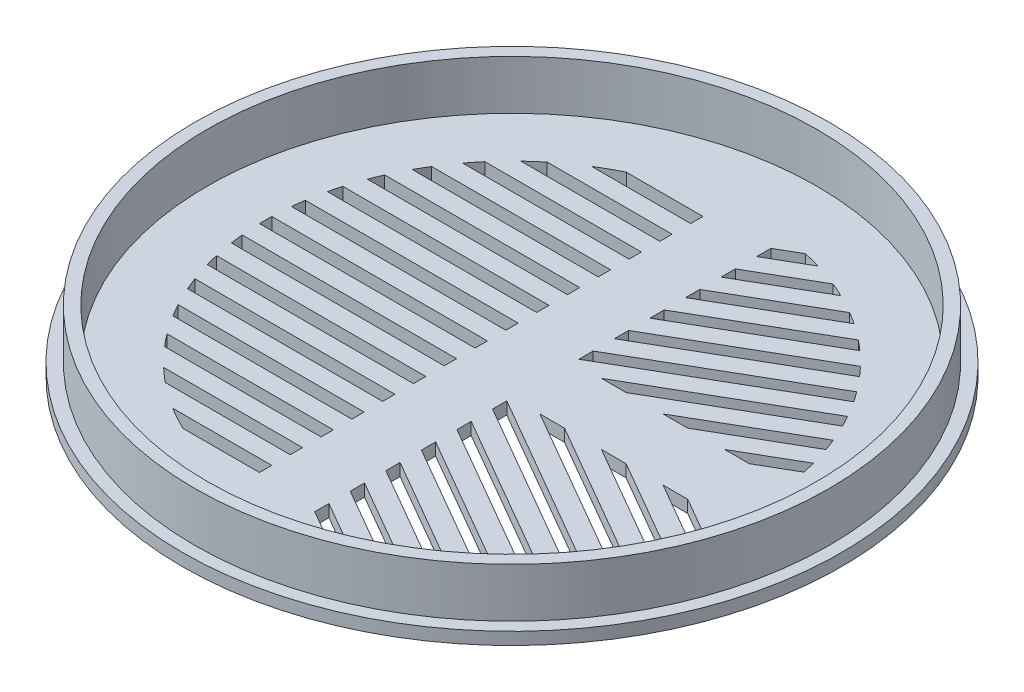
SolidWorks part; units mm, degrees
ref_plane "Front Plane" through (0, 0, 0) normal (0, 0, 1) x (1, 0, 0)
ref_plane "Top Plane" through (0, 0, 0) normal (0, 1, 0) x (1, 0, 0)
ref_plane "Right Plane" through (0, 0, 0) normal (1, 0, 0) x (0, 0, -1)
sketch "OuterCircles Sketch" plane through (0, 0, 0) normal (0, 1, 0) x (1, 0, 0)
  line L0 (0, 74.2626) -> (0, -74.2626) construction
  line L1 (0, -55) -> (0, 55) construction
  line L2 (-6.6339, 0) -> (6.6339, 0) construction
  line L3 (5, 0) -> (5, 39.6863) construction
  line L5 (0, -5) -> (0, 5) construction
  line L6 (0, 5) -> (39.6863, 5) construction
  circle A0 centre (0, 0) radius 51.5
  circle A1 centre (0, 0) radius 53.5
  circle A2 centre (0, 0) radius 49.5
  circle A4 centre (0, 0) radius 40 construction
  point P4 (0, 0)
  point P12 (19.8431, 0)
  dimension "D1" = 103
  dimension "D2" = 107
  dimension "D3" = 2
  dimension "D4" = 80
  dimension "D5" = 5
  dimension "D6" = 5
sketch "Sketch2" plane through (0, 0, 0) normal (0, 1, 0) x (1, 0, 0)
  circle A0 centre (0, 0) radius 53.5
  circle A3 centre (0, 0) radius 53.5 construction
extrude "BasePlate" add sketch "Sketch2" along normal blind 2
sketch "Horizontal Slits" plane through (0, 0, 0) normal (0, 1, 0) x (1, 0, 0)
  line L0 (-6.6339, 0) -> (6.6339, 0) construction
  line L1 (-55, 1) -> (-5, 1)
  line L2 (-55, 1) -> (-55, -1)
  line L3 (-55, -1) -> (-5, -1)
  line L4 (-5, 1) -> (-5, -1)
  line L5 (-55, 1) -> (-5, -1) construction
  line L6 (-55, -1) -> (-5, 1) construction
  line L7 (0, 74.2626) -> (0, -74.2626) construction
  line L8 (-55, 6) -> (-5, 6)
  line L9 (-55, 6) -> (-55, 4)
  line L10 (-55, 4) -> (-5, 4)
  line L11 (-5, 6) -> (-5, 4)
  line L12 (-55, 6) -> (-5, 4) construction
  line L13 (-55, 4) -> (-5, 6) construction
  line L14 (-55, 11) -> (-5, 11)
  line L15 (-55, 11) -> (-55, 9)
  line L16 (-55, 9) -> (-5, 9)
  line L17 (-5, 11) -> (-5, 9)
  line L18 (-55, 11) -> (-5, 9) construction
  line L19 (-55, 9) -> (-5, 11) construction
  line L20 (-55, 16) -> (-5, 16)
  line L21 (-55, 16) -> (-55, 14)
  line L22 (-55, 14) -> (-5, 14)
  line L23 (-5, 16) -> (-5, 14)
  line L24 (-55, 16) -> (-5, 14) construction
  line L25 (-55, 14) -> (-5, 16) construction
  line L26 (-55, 21) -> (-5, 21)
  line L27 (-55, 21) -> (-55, 19)
  line L28 (-55, 19) -> (-5, 19)
  line L29 (-5, 21) -> (-5, 19)
  line L30 (-55, 21) -> (-5, 19) construction
  line L31 (-55, 19) -> (-5, 21) construction
  line L32 (-55, 26) -> (-5, 26)
  line L33 (-55, 26) -> (-55, 24)
  line L34 (-55, 24) -> (-5, 24)
  line L35 (-5, 26) -> (-5, 24)
  line L36 (-55, 26) -> (-5, 24) construction
  line L37 (-55, 24) -> (-5, 26) construction
  line L38 (-55, 31) -> (-5, 31)
  line L39 (-55, 31) -> (-55, 29)
  line L40 (-55, 29) -> (-5, 29)
  line L41 (-5, 31) -> (-5, 29)
  line L42 (-55, 31) -> (-5, 29) construction
  line L43 (-55, 29) -> (-5, 31) construction
  line L44 (-55, 36) -> (-5, 36)
  line L45 (-55, 36) -> (-55, 34)
  line L46 (-55, 34) -> (-5, 34)
  line L47 (-5, 36) -> (-5, 34)
  line L48 (-55, 36) -> (-5, 34) construction
  line L49 (-55, 34) -> (-5, 36) construction
  line L50 (18.5063, 0) -> (35.3976, 0) construction
  line L51 (-55, -34) -> (-5, -36) construction
  line L52 (-55, -36) -> (-5, -34) construction
  line L53 (-55, -29) -> (-5, -31) construction
  line L54 (-55, -31) -> (-5, -29) construction
  line L55 (-55, -24) -> (-5, -26) construction
  line L56 (-55, -26) -> (-5, -24) construction
  line L57 (-55, -19) -> (-5, -21) construction
  line L58 (-55, -21) -> (-5, -19) construction
  line L59 (-55, -14) -> (-5, -16) construction
  line L60 (-55, -16) -> (-5, -14) construction
  line L61 (-55, -9) -> (-5, -11) construction
  line L62 (-55, -11) -> (-5, -9) construction
  line L63 (-55, -4) -> (-5, -6) construction
  line L64 (-55, -6) -> (-5, -4) construction
  line L65 (-5, -36) -> (-5, -34)
  line L66 (-55, -34) -> (-5, -34)
  line L67 (-55, -36) -> (-55, -34)
  line L68 (-55, -36) -> (-5, -36)
  line L69 (-5, -31) -> (-5, -29)
  line L70 (-55, -29) -> (-5, -29)
  line L71 (-55, -31) -> (-55, -29)
  line L72 (-55, -31) -> (-5, -31)
  line L73 (-5, -26) -> (-5, -24)
  line L74 (-55, -24) -> (-5, -24)
  line L75 (-55, -26) -> (-55, -24)
  line L76 (-55, -26) -> (-5, -26)
  line L77 (-5, -21) -> (-5, -19)
  line L78 (-55, -19) -> (-5, -19)
  line L79 (-55, -21) -> (-55, -19)
  line L80 (-55, -21) -> (-5, -21)
  line L81 (-5, -16) -> (-5, -14)
  line L82 (-55, -14) -> (-5, -14)
  line L83 (-55, -16) -> (-55, -14)
  line L84 (-55, -16) -> (-5, -16)
  line L85 (-5, -11) -> (-5, -9)
  line L86 (-55, -9) -> (-5, -9)
  line L87 (-55, -11) -> (-55, -9)
  line L88 (-55, -11) -> (-5, -11)
  line L89 (-5, -6) -> (-5, -4)
  line L90 (-55, -4) -> (-5, -4)
  line L91 (-55, -6) -> (-55, -4)
  line L92 (-55, -6) -> (-5, -6)
  point P0 (-30, 0)
  point P7 (-5, 0)
  point P12 (-30, 5)
  point P17 (-30, 10)
  point P22 (-30, 15)
  point P27 (-30, 20)
  point P32 (-30, 25)
  point P37 (-30, 30)
  point P42 (-30, 35)
  point P76 (-30, -35)
  point P77 (-30, -30)
  point P78 (-30, -25)
  point P79 (-30, -20)
  point P80 (-30, -15)
  point P81 (-30, -10)
  point P82 (-30, -5)
  dimension "D1" = 2
  dimension "D2" = 50
  dimension "D3" = 5
  dimension "D5" = 3
  dimension "D4" = 8
sketch "Angled Slits" plane through (0, 0, 0) normal (0, 1, 0) x (1, 0, 0)
  line L0 (-6.6339, 0) -> (6.6339, 0) construction
  line L1 (0, 74.2626) -> (0, -74.2626) construction
  line L3 (0, -2.8094) -> (0, -0.5)
  line L4 (0, -2.8094) -> (43.3013, 22.1906)
  line L5 (0, -0.5) -> (42.3013, 23.9226)
  line L6 (43.3013, 22.1906) -> (42.3013, 23.9226)
  line L7 (0, 2.9641) -> (0, 5.2735)
  line L8 (0, 5.2735) -> (42.3013, 29.6962)
  line L9 (0, 2.9641) -> (43.3013, 27.9641)
  line L10 (43.3013, 27.9641) -> (42.3013, 29.6962)
  line L11 (0, 8.7376) -> (0, 11.047)
  line L12 (0, 11.047) -> (42.3013, 35.4697)
  line L13 (0, 8.7376) -> (43.3013, 33.7376)
  line L14 (43.3013, 33.7376) -> (42.3013, 35.4697)
  line L15 (0, 14.5111) -> (0, 16.8205)
  line L16 (0, 16.8205) -> (42.3013, 41.2432)
  line L17 (0, 14.5111) -> (43.3013, 39.5111)
  line L18 (43.3013, 39.5111) -> (42.3013, 41.2432)
  line L19 (0, 20.2846) -> (0, 22.594)
  line L20 (0, 22.594) -> (42.3013, 47.0167)
  line L21 (0, 20.2846) -> (43.3013, 45.2846)
  line L22 (43.3013, 45.2846) -> (42.3013, 47.0167)
  line L23 (0, 26.0581) -> (0, 28.3675)
  line L24 (0, 28.3675) -> (42.3013, 52.7902)
  line L25 (0, 26.0581) -> (43.3013, 51.0581)
  line L26 (43.3013, 51.0581) -> (42.3013, 52.7902)
  line L27 (0, 31.8316) -> (0, 34.141)
  line L28 (0, 34.141) -> (42.3013, 58.5637)
  line L29 (0, 31.8316) -> (43.3013, 56.8316)
  line L30 (43.3013, 56.8316) -> (42.3013, 58.5637)
  line L31 (0, -8.5829) -> (0, -6.2735)
  line L32 (0, -6.2735) -> (42.3013, 18.1491)
  line L33 (0, -8.5829) -> (43.3013, 16.4171)
  line L34 (43.3013, 16.4171) -> (42.3013, 18.1491)
  line L35 (0, -14.3564) -> (0, -12.047)
  line L36 (0, -12.047) -> (42.3013, 12.3756)
  line L37 (0, -14.3564) -> (43.3013, 10.6436)
  line L38 (43.3013, 10.6436) -> (42.3013, 12.3756)
  dimension "D1" = 30
  dimension "D2" = 2
  dimension "D3" = 50
  dimension "D4" = 0.5
  dimension "D5" = 7
  dimension "D7" = 3
  dimension "D8" = 3
  dimension "D6" = 3
sketch "Horizontal Slit Cuts" plane through (0, 0, 0) normal (0, 1, 0) x (1, 0, 0)
  line L0 (-5, 11) -> (-5, 9) construction
  line L1 (-21.0713, 34) -> (-5, 34)
  line L2 (-5, 6) -> (-5, 4) construction
  line L3 (-17.4356, 36) -> (-5, 36)
  line L4 (-5, 34) -> (-5, 36)
  line L5 (-5, 1) -> (-5, -1) construction
  line L6 (-75.5452, 0) -> (-60.847, 0) construction
  line L7 (-6.6339, 0) -> (6.6339, 0) construction
  line L8 (-27.55, 29) -> (-5, 29)
  line L9 (-5, -4) -> (-5, -6)
  line L10 (-25.2784, 31) -> (-5, 31)
  line L11 (-5, 29) -> (-5, 31)
  line L12 (-39.5474, -6) -> (-5, -6)
  line L13 (-39.7995, -4) -> (-5, -4)
  line L14 (-32, 24) -> (-5, 24)
  line L15 (-5, -9) -> (-5, -11)
  line L16 (-30.3974, 26) -> (-5, 26)
  line L17 (-5, 24) -> (-5, 26)
  line L18 (-38.4578, -11) -> (-5, -11)
  line L19 (-38.9744, -9) -> (-5, -9)
  line L20 (-35.1994, 19) -> (-5, 19)
  line L21 (-5, -14) -> (-5, -16)
  line L22 (-34.0441, 21) -> (-5, 21)
  line L23 (-5, 19) -> (-5, 21)
  line L24 (-36.6606, -16) -> (-5, -16)
  line L25 (-37.47, -14) -> (-5, -14)
  line L26 (-37.47, 14) -> (-5, 14)
  line L27 (-5, -19) -> (-5, -21)
  line L28 (-36.6606, 16) -> (-5, 16)
  line L29 (-5, 14) -> (-5, 16)
  line L30 (-34.0441, -21) -> (-5, -21)
  line L31 (-35.1994, -19) -> (-5, -19)
  line L32 (-38.9744, 9) -> (-5, 9)
  line L33 (-5, -24) -> (-5, -26)
  line L34 (-38.4578, 11) -> (-5, 11)
  line L35 (-5, 9) -> (-5, 11)
  line L36 (-30.3974, -26) -> (-5, -26)
  line L37 (-32, -24) -> (-5, -24)
  line L38 (-5, -29) -> (-5, -31)
  line L39 (-39.7995, 4) -> (-5, 4)
  line L40 (-25.2784, -31) -> (-5, -31)
  line L41 (-39.5474, 6) -> (-5, 6)
  line L42 (-5, 4) -> (-5, 6)
  line L43 (-27.55, -29) -> (-5, -29)
  line L44 (-5, -34) -> (-5, -36)
  line L45 (-39.9875, -1) -> (-5, -1)
  line L46 (-17.4356, -36) -> (-5, -36)
  line L47 (-39.9875, 1) -> (-5, 1)
  line L48 (-5, -1) -> (-5, 1)
  line L49 (-21.0713, -34) -> (-5, -34)
  arc A0 (-17.4356, 36) -> (-21.0713, 34) centre (0, 0) ccw
  arc A1 (-25.2784, -31) -> (-27.55, -29) centre (0, 0) cw
  arc A2 (-30.3974, -26) -> (-32, -24) centre (0, 0) cw
  arc A3 (-34.0441, -21) -> (-35.1994, -19) centre (0, 0) cw
  arc A4 (-36.6606, -16) -> (-37.47, -14) centre (0, 0) cw
  arc A5 (-38.4578, -11) -> (-38.9744, -9) centre (0, 0) cw
  arc A6 (-39.5474, -6) -> (-39.7995, -4) centre (0, 0) cw
  arc A7 (-17.4356, -36) -> (-21.0713, -34) centre (0, 0) cw
  arc A9 (-39.9875, 1) -> (-39.9875, -1) centre (0, 0) ccw
  arc A10 (-39.5474, 6) -> (-39.7995, 4) centre (0, 0) ccw
  arc A11 (-38.4578, 11) -> (-38.9744, 9) centre (0, 0) ccw
  arc A12 (-36.6606, 16) -> (-37.47, 14) centre (0, 0) ccw
  arc A13 (-34.0441, 21) -> (-35.1994, 19) centre (0, 0) ccw
  arc A14 (-30.3974, 26) -> (-32, 24) centre (0, 0) ccw
  arc A15 (-25.2784, 31) -> (-27.55, 29) centre (0, 0) ccw
  circle A16 centre (0, 0) radius 40 construction
extrude "Slits - Horizontal" cut sketch "Horizontal Slit Cuts" against normal mid plane 20
sketch "Angled Slit Cuts" plane through (0, 0, 0) normal (0, 1, 0) x (1, 0, 0)
  line L0 (5, 37.0278) -> (8.5477, 39.076)
  line L1 (5, 31.2543) -> (5, 28.9449)
  line L2 (5, 37.0278) -> (5, 34.7184)
  line L3 (5, 34.7184) -> (11.3172, 38.3656)
  line L4 (5, 31.2543) -> (15.0542, 37.059)
  line L5 (5, 25.4808) -> (5, 23.1714)
  line L6 (5, 19.7073) -> (5, 17.3979)
  line L7 (5, 28.9449) -> (17.3181, 36.0567)
  line L8 (5, 25.4808) -> (20.4299, 34.3892)
  line L9 (5, 13.9338) -> (5, 11.6244)
  line L10 (33.5263, 5) -> (29.5263, 5)
  line L11 (5, 23.1714) -> (22.3381, 33.1815)
  line L12 (5, 19.7073) -> (24.9787, 31.242)
  line L13 (5, 8.1603) -> (5, 5.8509)
  line L14 (13.5263, 5) -> (9.5263, 5)
  line L15 (5, 17.3979) -> (26.6035, 29.8706)
  line L16 (5, 13.9338) -> (28.8521, 27.7048)
  line L17 (23.5263, 5) -> (19.5263, 5)
  line L18 (0, -0.5) -> (42.3013, 23.9226) construction
  line L19 (5, 11.6244) -> (30.232, 26.1921)
  line L20 (5, 8.1603) -> (32.131, 23.8243)
  line L21 (0, -2.8094) -> (43.3013, 22.1906) construction
  line L22 (5, 0) -> (5, 39.6863) construction
  line L23 (5, 5.8509) -> (33.2861, 22.1818)
  line L24 (9.5263, 5) -> (34.8555, 19.6238)
  line L25 (0, 5) -> (39.6863, 5) construction
  line L26 (0, -8.5829) -> (43.3013, 16.4171) construction
  line L27 (13.5263, 5) -> (35.7934, 17.8559)
  line L28 (19.5263, 5) -> (37.0365, 15.1095)
  line L29 (0, -6.2735) -> (42.3013, 18.1491) construction
  line L30 (0, -14.3564) -> (43.3013, 10.6436) construction
  line L31 (23.5263, 5) -> (37.7542, 13.2145)
  line L32 (29.5263, 5) -> (38.6585, 10.2725)
  line L33 (0, -12.047) -> (42.3013, 12.3756) construction
  line L34 (0, 5.2735) -> (42.3013, 29.6962) construction
  line L35 (33.5263, 5) -> (39.1417, 8.242)
  line L36 (0, 2.9641) -> (43.3013, 27.9641) construction
  line L37 (0, 8.7376) -> (43.3013, 33.7376) construction
  line L38 (0, 11.047) -> (42.3013, 35.4697) construction
  line L39 (0, 16.8205) -> (42.3013, 41.2432) construction
  line L40 (0, 14.5111) -> (43.3013, 39.5111) construction
  line L41 (0, 31.8316) -> (43.3013, 56.8316) construction
  line L42 (0, 34.141) -> (42.3013, 58.5637) construction
  line L43 (0, 28.3675) -> (42.3013, 52.7902) construction
  line L44 (0, 26.0581) -> (43.3013, 51.0581) construction
  line L45 (0, 22.594) -> (42.3013, 47.0167) construction
  line L46 (0, 20.2846) -> (43.3013, 45.2846) construction
  arc A0 (8.5477, 39.076) -> (11.3172, 38.3656) centre (0, 0) cw
  arc A1 (15.0542, 37.059) -> (17.3181, 36.0567) centre (0, 0) cw
  arc A2 (20.4299, 34.3892) -> (22.3381, 33.1815) centre (0, 0) cw
  arc A3 (24.9787, 31.242) -> (26.6035, 29.8706) centre (0, 0) cw
  arc A4 (28.8521, 27.7048) -> (30.232, 26.1921) centre (0, 0) cw
  arc A5 (32.131, 23.8243) -> (33.2861, 22.1818) centre (0, 0) cw
  arc A6 (34.8555, 19.6238) -> (35.7934, 17.8559) centre (0, 0) cw
  arc A7 (37.0365, 15.1095) -> (37.7542, 13.2145) centre (0, 0) cw
  arc A8 (38.6585, 10.2725) -> (39.1417, 8.242) centre (0, 0) cw
  circle A9 centre (0, 0) radius 40 construction
extrude "Slits - Angled" cut sketch "Angled Slit Cuts" against normal mid plane 20
mirror "Mirror1" about plane through (0, 0, 0) normal (0, 0, 1) of "Slits - Angled"
sketch "Sketch3" plane through (0, 2, 0) normal (0, 1, 0) x (1, 0, 0)
  circle A0 centre (0, 0) radius 51.5
  circle A1 centre (0, 0) radius 49.5
  circle A2 centre (0, 0) radius 51.5 construction
  circle A3 centre (0, 0) radius 49.5 construction
extrude "Collar" add sketch "Sketch3" along normal blind 8
